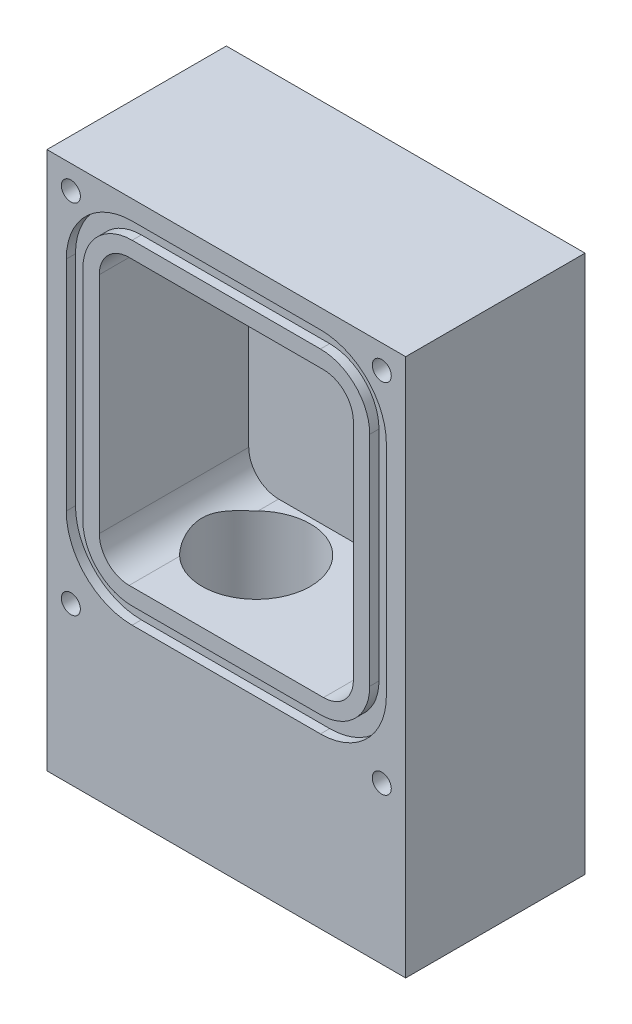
SolidWorks part; units mm, degrees
ref_plane "Front Plane" through (0, 0, 0) normal (0, 0, 1) x (1, 0, 0)
ref_plane "Top Plane" through (0, 0, 0) normal (0, 1, 0) x (1, 0, 0)
ref_plane "Right Plane" through (0, 0, 0) normal (1, 0, 0) x (0, 0, -1)
sketch "Sketch1" plane through (0, 0, 0) normal (0, 0, 1) x (1, 0, 0)
  line L1 (0, 0) -> (76.2, 0)
  line L2 (0, 0) -> (0, 114.3)
  line L3 (0, 114.3) -> (76.2, 114.3)
  line L4 (76.2, 0) -> (76.2, 114.3)
  dimension "D1" = 76.2
  dimension "D2" = 114.3
extrude "Boss-Extrude1" add sketch "Sketch1" along normal blind 38.1
sketch "Sketch2" plane through (0, 0, 38.1) normal (0, 0, 1) x (1, 0, 0)
  line L0 (76.2, 114.3) -> (0, 114.3) construction
  line L1 (17.4625, 42.8625) -> (58.7375, 42.8625)
  line L2 (11.1125, 49.2125) -> (11.1125, 96.8375)
  line L3 (17.4625, 103.1875) -> (58.7375, 103.1875)
  line L4 (65.0875, 49.2125) -> (65.0875, 96.8375)
  line L6 (38.1, 0) -> (38.1, 42.8625) construction
  line L7 (0, 0) -> (76.2, 0) construction
  arc A0 (11.1125, 49.2125) -> (17.4625, 42.8625) centre (17.4625, 49.2125) ccw
  arc A1 (65.0875, 49.2125) -> (58.7375, 42.8625) centre (58.7375, 49.2125) cw
  arc A2 (65.0875, 96.8375) -> (58.7375, 103.1875) centre (58.7375, 96.8375) ccw
  arc A3 (17.4625, 103.1875) -> (11.1125, 96.8375) centre (17.4625, 96.8375) ccw
  point P14 (11.1125, 42.8625)
  point P19 (65.0875, 103.1875)
  point P22 (11.1125, 103.1875)
  dimension "D3" = 6.35
  dimension "D1" = 60.325
  dimension "D2" = 53.975
  dimension "D4" = 11.1125
extrude "Cut-Extrude1" cut sketch "Sketch2" against normal blind 31.75
hole_wizard "3/4 NPT Tapped Hole1" positions "Sketch4" profile "Sketch5" size "3/4" standard "ANSI Inch"
sketch "Sketch4" plane through (0, 0, 0) normal (0, -1, 0) x (-1, 0, 0)
  line L0 (0, -38.1) -> (0, 0) construction
  line L1 (0, -19.05) -> (-25.4, -19.05) construction
  point P0 (-25.4, -19.05)
  dimension "D1" = 25.4
sketch "Sketch5" plane through (25.4, 0, 19.05) normal (1, 0, 0) x (0, 0, -1)
  line L0 (0, 0) -> (0, 56.1261)
  line L1 (11.5062, 49.2125) -> (0, 56.1261)
  line L2 (-11.5062, 49.2125) -> (0, 56.1261) construction
  line L3 (11.5062, 49.2125) -> (11.5062, 13.97)
  line L4 (11.5062, 13.97) -> (12.9332, 13.97)
  line L5 (12.9332, 13.97) -> (13.3325, 0.635)
  line L6 (13.3325, 0.635) -> (13.9675, 0)
  line L7 (13.9675, 0) -> (0, 0)
  line L8 (0, -6.35) -> (0, 107.95) construction
  line L9 (-13.3325, 0.635) -> (-13.9675, 0) construction
  line L11 (-11.5062, 13.97) -> (-12.9332, 13.97) construction
  line L12 (-12.9332, 13.97) -> (-13.3325, 0.635) construction
  dimension "Tap Drill Dia." = 23.0124
  dimension "Tap Drill Depth" = 49.2125
  dimension "Thread Dia." = 26.665
  dimension "Thread Angle" = 3.43
  dimension "Thread Depth" = 13.97
  dimension "C'Sink Dia." = 27.935
  dimension "C'Sink Angle" = 90
  dimension "Drill Angle" = 118
hole_wizard "7/16-20 Tapped Hole1" positions "Sketch7" profile "Sketch6" tap size "7/16-20" standard "ANSI Inch"
sketch "Sketch7" plane through (0, 0, 0) normal (0, -1, 0) x (-1, 0, 0)
  line L0 (-76.2, -19.05) -> (-59.69, -19.05) construction
  line L1 (-76.2, -38.1) -> (-76.2, 0) construction
  point P0 (-59.69, -19.05)
  dimension "D1" = 16.51
sketch "Sketch6" plane through (59.69, 0, 19.05) normal (1, 0, 0) x (0, 0, -1)
  line L0 (0, 0) -> (0, 54.3494)
  line L1 (0, 54.3494) -> (4.9606, 49.2125)
  line L2 (4.9606, 49.2125) -> (4.9606, 0)
  line L5 (4.9606, 0) -> (0, 0)
  line L10 (0, 54.3494) -> (-4.9606, 49.2125) construction
  line L11 (0, -6.35) -> (0, 107.95) construction
  dimension "Tap Drill Dia." = 9.9212
  dimension "Tap Drill Depth" = 49.2125
  dimension "Drill Angle" = 88
sketch "Sketch8" plane through (0, 0, 38.1) normal (0, 0, 1) x (1, 0, 0)
  line L0 (7.6327, 96.2025) -> (7.6327, 49.8475)
  line L1 (18.0975, 39.3827) -> (58.1025, 39.3827)
  line L2 (68.5673, 49.8475) -> (68.5673, 96.2025)
  line L3 (58.1025, 106.6673) -> (18.0975, 106.6673)
  line L4 (38.1, 106.6673) -> (38.1, 103.1875) construction
  line L5 (58.7375, 103.1875) -> (17.4625, 103.1875) construction
  line L6 (11.1125, 73.025) -> (7.6327, 73.025) construction
  line L7 (11.1125, 96.8375) -> (11.1125, 49.2125) construction
  line L8 (4.1021, 96.2025) -> (4.1021, 49.8475)
  line L9 (18.0975, 35.8521) -> (58.1025, 35.8521)
  line L10 (72.0979, 49.8475) -> (72.0979, 96.2025)
  line L11 (58.1025, 110.1979) -> (18.0975, 110.1979)
  arc A0 (58.1025, 39.3827) -> (68.5673, 49.8475) centre (58.1025, 49.8475) ccw
  arc A1 (68.5673, 96.2025) -> (58.1025, 106.6673) centre (58.1025, 96.2025) ccw
  arc A2 (18.0975, 106.6673) -> (7.6327, 96.2025) centre (18.0975, 96.2025) ccw
  arc A3 (18.0975, 39.3827) -> (7.6327, 49.8475) centre (18.0975, 49.8475) cw
  arc A4 (18.0975, 35.8521) -> (4.1021, 49.8475) centre (18.0975, 49.8475) cw
  arc A5 (58.1025, 35.8521) -> (72.0979, 49.8475) centre (58.1025, 49.8475) ccw
  arc A6 (72.0979, 96.2025) -> (58.1025, 110.1979) centre (58.1025, 96.2025) ccw
  arc A7 (18.0975, 110.1979) -> (4.1021, 96.2025) centre (18.0975, 96.2025) ccw
  dimension "D2" = 10.4648
  dimension "D3" = 46.355
  dimension "D4" = 40.005
  dimension "D1" = 3.5306
extrude "Cut-Extrude2" cut sketch "Sketch8" against normal blind 1.9558
hole_wizard "#10-32 Tapped Hole1" positions "Sketch10" profile "Sketch9" tap size "#10-32" standard "ANSI Inch"
sketch "Sketch10" plane through (0, 0, 38.1) normal (0, 0, 1) x (1, 0, 0)
  line L0 (76.2, 114.3) -> (0, 114.3) construction
  line L1 (0, 114.3) -> (0, 0) construction
  line L2 (76.2, 0) -> (76.2, 114.3) construction
  line L3 (18.0975, 35.8521) -> (58.1025, 35.8521) construction
  point P0 (5.08, 33.3121)
  point P2 (71.12, 33.3121)
  point P4 (71.12, 109.22)
  point P6 (5.08, 109.22)
  dimension "D1" = 5.08
  dimension "D2" = 5.08
  dimension "D3" = 5.08
  dimension "D4" = 2.54
sketch "Sketch9" plane through (5.08, 33.3121, 38.1) normal (1, 0, 0) x (0, -1, 0)
  line L0 (0, 0) -> (0, 21.141)
  line L1 (0, 21.141) -> (2.0193, 19.05)
  line L2 (2.0193, 19.05) -> (2.0193, 0)
  line L5 (2.0193, 0) -> (0, 0)
  line L10 (0, 21.141) -> (-2.0193, 19.05) construction
  line L11 (0, -6.35) -> (0, 107.95) construction
  dimension "Tap Drill Dia." = 4.0386
  dimension "Tap Drill Depth" = 19.05
  dimension "Drill Angle" = 88
